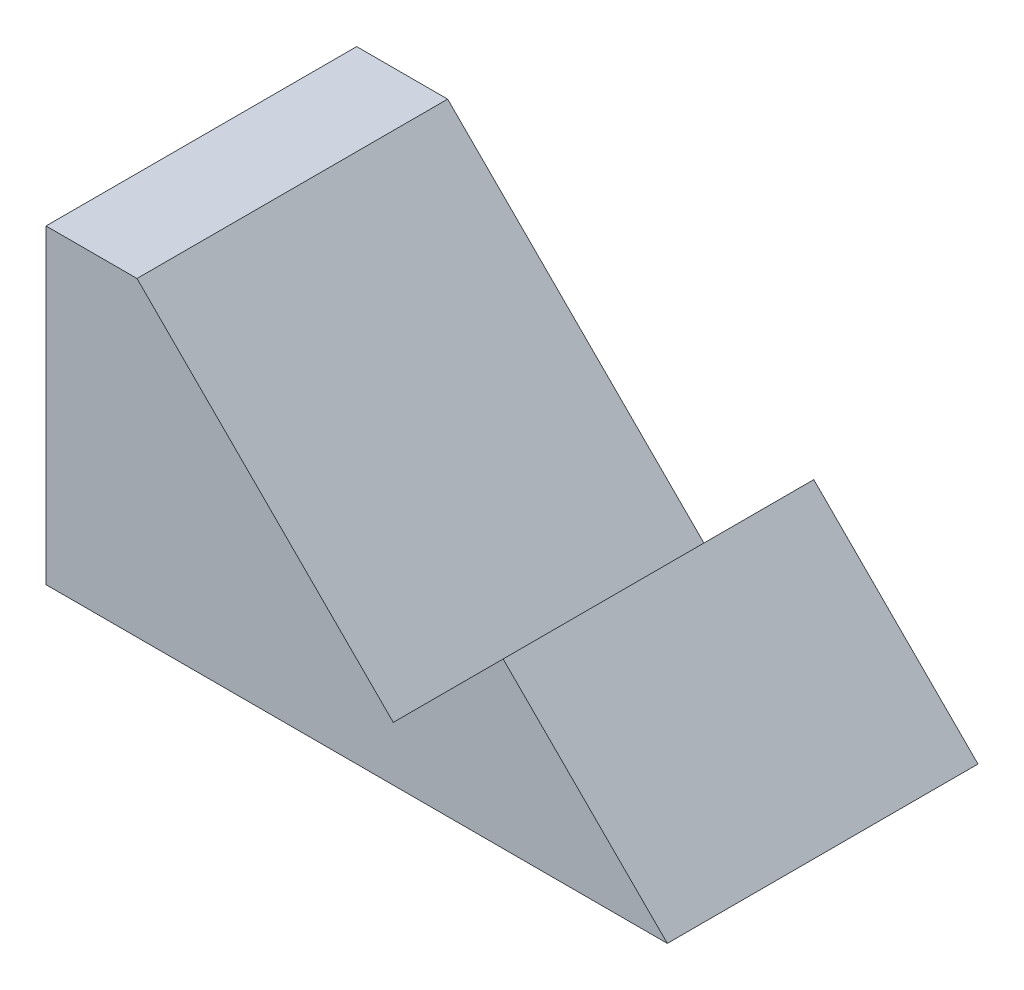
SolidWorks part; units mm, degrees
ref_plane "Front Plane" through (0, 0, 0) normal (0, 0, 1) x (1, 0, 0)
ref_plane "Top Plane" through (0, 0, 0) normal (0, 1, 0) x (1, 0, 0)
ref_plane "Right Plane" through (0, 0, 0) normal (1, 0, 0) x (0, 0, -1)
sketch "Sketch1" plane through (0, 0, 0) normal (0, 0, 1) x (1, 0, 0)
  line L0 (0, 0) -> (76.2, 0)
  line L1 (76.2, 0) -> (56.0605, 20.1395)
  line L2 (56.0605, 20.1395) -> (42.5901, 6.6691)
  line L3 (42.5901, 6.6691) -> (11.1592, 38.1)
  line L4 (11.1592, 38.1) -> (0, 38.1)
  line L5 (0, 38.1) -> (0, 0)
  dimension "D1" = 38.1
  dimension "D2" = 19.05
  dimension "D3" = 76.2
  dimension "D4" = 45
  dimension "D5" = 44.45
extrude "Extrude1" add sketch "Sketch1" along normal blind 38.1
